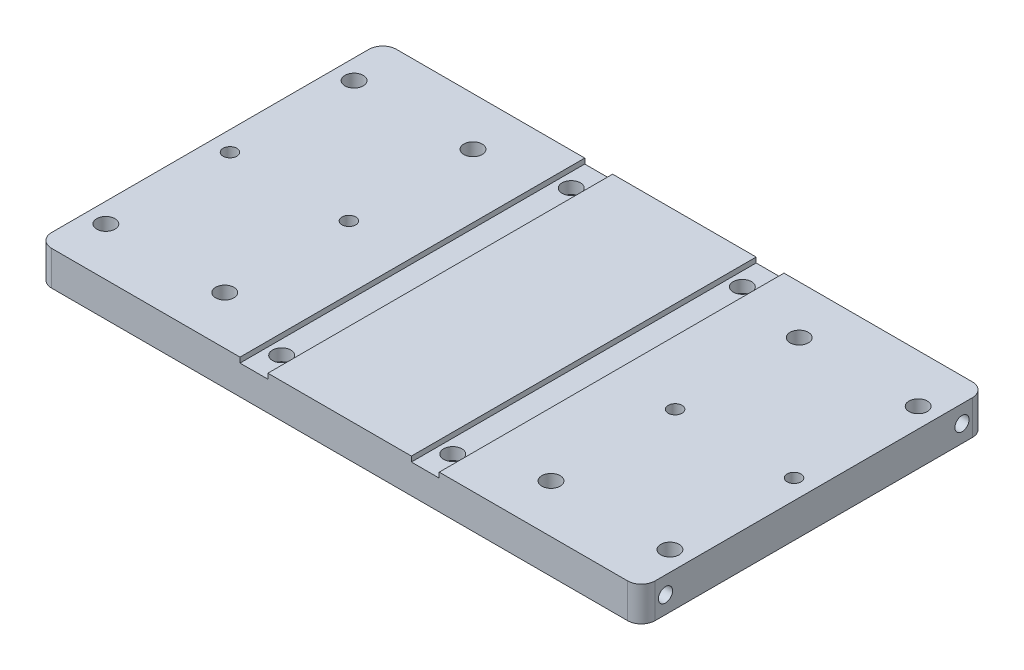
SolidWorks part; units mm, degrees
ref_plane "Front Plane" through (0, 0, 0) normal (0, 0, 1) x (1, 0, 0)
ref_plane "Top Plane" through (0, 0, 0) normal (0, 1, 0) x (1, 0, 0)
ref_plane "Right Plane" through (0, 0, 0) normal (1, 0, 0) x (0, 0, -1)
sketch "Sketch1" plane through (0, 0, 0) normal (0, 1, 0) x (1, 0, 0)
  line L1 (-138.938, 79.375) -> (138.938, 79.375)
  line L2 (-138.938, 79.375) -> (-138.938, -79.375)
  line L3 (-138.938, -79.375) -> (138.938, -79.375)
  line L4 (138.938, 79.375) -> (138.938, -79.375)
  line L5 (-138.938, 79.375) -> (138.938, -79.375) construction
  line L6 (-138.938, -79.375) -> (138.938, 79.375) construction
  point P0 (0, 0)
  dimension "D1" = 277.876
  dimension "D2" = 158.75
extrude "Boss-Extrude1" add sketch "Sketch1" along normal mid plane 15.875
sketch "Sketch2" plane through (0, 0, -79.375) normal (0, 0, -1) x (-1, 0, 0)
  line L0 (-138.938, 7.9375) -> (138.938, 7.9375) construction
  line L1 (-33.0454, 5.5515) -> (-45.8724, 5.5515)
  line L2 (-33.0454, 5.5515) -> (-33.0454, 7.9375)
  line L3 (-33.0454, 7.9375) -> (-45.8724, 7.9375)
  line L4 (-45.8724, 5.5515) -> (-45.8724, 7.9375)
  line L8 (0, -7.9375) -> (0, -18.9201) construction
  line L9 (-138.938, -7.9375) -> (138.938, -7.9375) construction
  line L10 (45.8724, 5.5515) -> (45.8724, 7.9375)
  line L11 (33.0454, 7.9375) -> (45.8724, 7.9375)
  line L12 (33.0454, 5.5515) -> (33.0454, 7.9375)
  line L13 (33.0454, 5.5515) -> (45.8724, 5.5515)
  line L14 (-45.7454, 53.8115) -> (-45.7454, 5.5515) construction
  line L15 (-33.0454, 53.8115) -> (-33.0454, 5.5515) construction
  dimension "D1" = 0.127
  dimension "D2" = 2.386
extrude "Cut-Extrude1" cut sketch "Sketch2" against normal through all
hole_wizard "CBORE for 5/16 Socket Head Cap Screw1" positions "Sketch3" profile "Sketch4" counterbore size "5/16" standard "ANSI Inch"
sketch "Sketch3" plane through (0, -7.9375, 0) normal (0, -1, 0) x (-1, 0, 0)
  point P0 (39.3954, 66.675)
  point P3 (39.3954, -66.675)
  point P6 (-39.3954, -66.675)
  point P9 (-39.3954, 66.675)
sketch "Sketch4" plane through (-39.3954, -7.9375, -66.675) normal (1, 0, 0) x (0, 0, -1)
  line L0 (0, 0) -> (0, 15.875)
  line L1 (0, 15.875) -> (4.2164, 15.875)
  line L3 (4.2164, 15.875) -> (4.2164, 7.9375)
  line L4 (4.2164, 7.9375) -> (6.7475, 7.9375)
  line L5 (6.7475, 7.9375) -> (6.7475, 0)
  line L7 (6.7475, 0) -> (0, 0)
  line L11 (0, -6.35) -> (0, 107.95) construction
  dimension "Thru Hole Dia." = 8.4328
  dimension "Thru Hole Depth" = 15.875
  dimension "C'Bore Dia." = 13.495
  dimension "C'Bore Depth" = 7.9375
hole_wizard "5/16-18 Tapped Hole1" positions "Sketch5" profile "Sketch6" tap size "5/16-18" standard "ANSI Inch"
sketch "Sketch5" plane through (138.938, -112.7125, 0) normal (1, 0, 0) x (0, -1, 0)
  line L0 (-104.775, 0) -> (-88.0842, 0) construction
  line L1 (-104.775, -79.375) -> (-104.775, 79.375) construction
  line L3 (-112.7125, 79.375) -> (-112.7125, 68.2625) construction
  line L4 (-120.65, 79.375) -> (-104.775, 79.375) construction
  point P0 (-112.7125, -68.2625)
  point P3 (-112.7125, 68.2625)
  dimension "D1" = 11.1125
sketch "Sketch6" plane through (138.938, 0, 68.2625) normal (0, 1, 0) x (0, 0, -1)
  line L0 (0, 0) -> (0, 22.2811)
  line L1 (0, 22.2811) -> (3.2639, 20.32)
  line L2 (3.2639, 20.32) -> (3.2639, 0)
  line L5 (3.2639, 0) -> (0, 0)
  line L10 (0, 22.2811) -> (-3.2639, 20.32) construction
  line L11 (0, -6.35) -> (0, 107.95) construction
  dimension "Tap Drill Dia." = 6.5278
  dimension "Tap Drill Depth" = 20.32
  dimension "Drill Angle" = 118
hole_wizard "CBORE for 5/16 Socket Head Cap Screw2" positions "Sketch7" profile "Sketch8" counterbore size "5/16" standard "ANSI Inch"
sketch "Sketch7" plane through (0, -7.9375, 0) normal (0, -1, 0) x (-1, 0, 0)
  point P0 (75.1078, 57.15)
  point P3 (75.1078, -57.15)
  point P6 (129.8702, -57.15)
  point P9 (129.8702, 57.15)
  point P12 (-129.8702, -57.15)
  point P15 (-129.8702, 57.15)
  point P18 (-75.1078, -57.15)
  point P21 (-75.1078, 57.15)
sketch "Sketch8" plane through (-75.1078, -7.9375, -57.15) normal (1, 0, 0) x (0, 0, -1)
  line L0 (0, 0) -> (0, 15.875)
  line L1 (0, 15.875) -> (4.2164, 15.875)
  line L3 (4.2164, 15.875) -> (4.2164, 7.9375)
  line L4 (4.2164, 7.9375) -> (6.7475, 7.9375)
  line L5 (6.7475, 7.9375) -> (6.7475, 0)
  line L7 (6.7475, 0) -> (0, 0)
  line L11 (0, -6.35) -> (0, 107.95) construction
  dimension "Thru Hole Dia." = 8.4328
  dimension "Thru Hole Depth" = 15.875
  dimension "C'Bore Dia." = 13.495
  dimension "C'Bore Depth" = 7.9375
hole_wizard "1/4 (0.2500) Dowel Hole1" positions "Sketch9" profile "Sketch10" hole size "1/4" standard "ANSI Inch"
sketch "Sketch9" plane through (0, 7.9375, 0) normal (0, 1, 0) x (1, 0, 0)
  point P0 (129.8702, 0)
  point P3 (75.1078, 0)
  point P6 (-129.8702, 0)
  point P9 (-75.1078, 0)
sketch "Sketch10" plane through (129.8702, 7.9375, 0) normal (1, 0, 0) x (0, 0, 1)
  line L0 (0, 0) -> (0, 15.875)
  line L1 (0, 15.875) -> (3.175, 15.875)
  line L2 (3.175, 15.875) -> (3.175, 0)
  line L5 (3.175, 0) -> (0, 0)
  line L11 (0, -6.35) -> (0, 107.95) construction
  dimension "Thru Hole Dia." = 6.35
  dimension "Thru Hole Depth" = 15.875
mirror "Mirror1" about plane through (0, 0, 0) normal (1, 0, 0) of "5/16-18 Tapped Hole1"
fillet "Fillet1" radius 6.35 4 edges at (-138.938, 0, 79.375) (-138.938, 0, -79.375) (138.938, 0, -79.375) (138.938, 0, 79.375)
